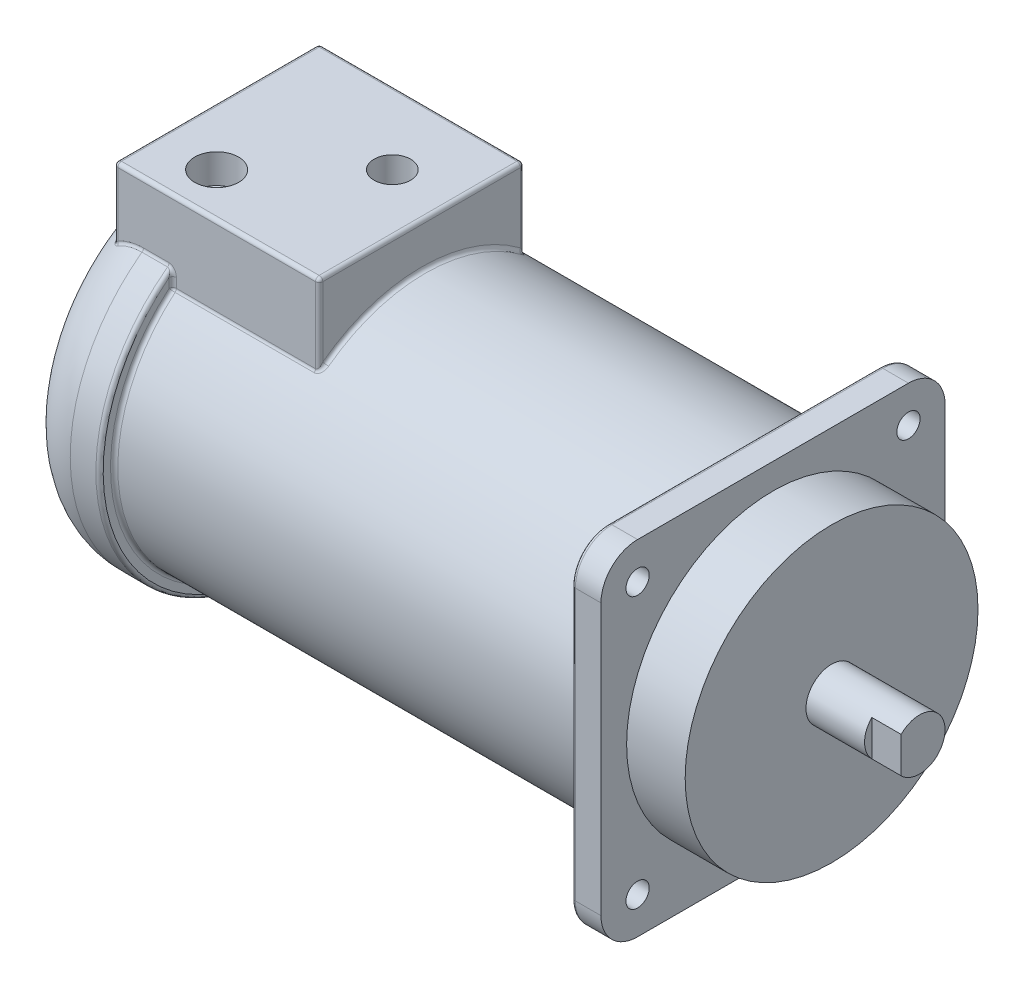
SolidWorks part; units mm, degrees
ref_plane "front" through (0, 0, 0) normal (0, 0, 1) x (1, 0, 0)
ref_plane "top" through (0, 0, 0) normal (0, 1, 0) x (1, 0, 0)
ref_plane "side" through (0, 0, 0) normal (1, 0, 0) x (0, 0, -1)
sketch "Sketch1" plane through (0, 0, 0) normal (0, 0, 1) x (1, 0, 0)
  line L0 (0, 0) -> (63.4876, 0) construction
  line L1 (0, 0) -> (0, 11.1125)
  line L2 (0, 11.1125) -> (-63.5, 11.1125)
  line L3 (-63.5, 11.1125) -> (-63.5, 69.85)
  line L6 (-63.5, 69.85) -> (-279.4, 69.85)
  line L7 (-279.4, 69.85) -> (-279.4, 76.2)
  line L8 (-279.4, 76.2) -> (-292.1, 76.2)
  line L9 (-317.5, 50.8) -> (-317.5, 0)
  line L10 (-317.5, 0) -> (0, 0)
  arc A0 (-292.1, 76.2) -> (-317.5, 50.8) centre (-292.1, 50.8) ccw
  dimension "D3" = 25.4
  dimension "D1" = 69.85
  dimension "D2" = 76.2
  dimension "D4" = 38.1
  dimension "D5" = 254
  dimension "D6" = 63.5
  dimension "D7" = 22.225
revolve "Base-Revolve" add sketch "Sketch1" angle 360 about L0
sketch "Sketch2" plane through (-63.5, 0, 0) normal (1, 0, 0) x (0, 0, -1)
  line L0 (0, 0) -> (0, 105.8986) construction
  line L1 (0, 0) -> (105.8986, 0) construction
  line L2 (74.6125, -58.7375) -> (74.6125, 58.7375)
  line L3 (58.7375, 74.6125) -> (-58.7375, 74.6125)
  line L4 (-74.6125, -58.7375) -> (-74.6125, 58.7375)
  line L5 (58.7375, -74.6125) -> (-58.7375, -74.6125)
  arc A0 (74.6125, 58.7375) -> (58.7375, 74.6125) centre (58.7375, 58.7375) ccw
  arc A1 (-74.6125, 58.7375) -> (-58.7375, 74.6125) centre (-58.7375, 58.7375) cw
  arc A2 (-74.6125, -58.7375) -> (-58.7375, -74.6125) centre (-58.7375, -58.7375) ccw
  arc A3 (74.6125, -58.7375) -> (58.7375, -74.6125) centre (58.7375, -58.7375) cw
  point P10 (0, 74.6125)
  point P11 (74.6125, 0)
  point P18 (-74.6125, 0)
  point P19 (0, -74.6125)
  dimension "D1" = 15.875
  dimension "D2" = 149.225
extrude "Boss-Extrude1" add sketch "Sketch2" against normal blind 12.7
ref_plane "Plane4" through (-215.9, 0, 0) normal (1, 0, 0) x (0, 0, -1)
sketch "Sketch3" plane through (-215.9, 0, 0) normal (1, 0, 0) x (0, 0, -1)
  line L0 (0, 0) -> (0, 88.9) construction
  line L1 (-44.45, 88.9) -> (44.45, 88.9)
  line L2 (-44.45, 88.9) -> (-44.45, 24.5934)
  line L3 (44.45, 24.5934) -> (-44.45, 24.5934)
  line L4 (44.45, 24.5934) -> (44.45, 88.9)
  circle A3 centre (0, 0) radius 50.8 construction
  circle A4 centre (0, 0) radius 11.1125 construction
  dimension "D2" = 88.9
  dimension "D1" = 88.9
extrude "Boss-Extrude2" add sketch "Sketch3" against normal blind 88.9
sketch "Sketch4" plane through (-63.5, 0, 0) normal (1, 0, 0) x (0, 0, -1)
  circle A0 centre (0, 0) radius 63.5
  dimension "D1" = 127
extrude "pilot dia" add sketch "Sketch4" along normal blind 25.4
sketch "Sketch6" plane through (0, 88.9, 0) normal (0, 1, 0) x (-1, 0, 0)
  line L0 (304.8, 44.45) -> (304.8, -44.45) construction
  line L1 (304.8, -44.45) -> (215.9, -44.45) construction
  circle A0 centre (279.4, 25.4) radius 9.525
  circle A1 centre (241.3, -12.7) radius 7.9375
  dimension "D1" = 25.4
  dimension "D2" = 38.1
  dimension "D3" = 31.75
  dimension "D4" = 38.1
  dimension "D5" = 19.05
  dimension "D6" = 15.875
extrude "Cut-Extrude2" cut sketch "Sketch6" against normal blind 12.7
fillet "Fillet1" radius 1.5875 7 edges at (-282.5238, -59.5693, -44.45) (-279.4, -76.2, 0) (-279.4, -69.85, 0) (-215.9, 71.3908, 44.45) (-215.9, 71.3908, -44.45) (-304.8, 73.2754, 44.45) (-304.8, 73.2754, -44.45)
fillet "Fillet2" radius 1.5875 18 edges at (-300.1465, 60.2742, 44.45) (-286.5437, 61.8921, -44.45) (-215.9, 69.85, 0) (-247.65, 53.8815, 44.45) (-286.5437, 61.8921, 44.45) (-279.4, 57.9255, 44.45) (-278.9494, 54.5017, 44.45) (-247.65, 53.8815, -44.45) (-279.4, 57.9255, -44.45) (-282.5238, -59.5693, -44.45) (-278.6382, 54.1815, -44.45) (-304.8, 72.797, 0) (-216.3546, 54.2703, 43.9745) (-216.6612, 54.0721, -44.218) (-304.2521, 58.3333, -44.0623) (-304.3887, 58.3401, 43.9287) (-279.7974, 61.23, 44.45) (-279.8536, 61.3046, -44.45)
fillet "Fillet3" radius 1.5875 17 edges at (-76.2, 0, -69.85) (-76.2, -69.9628, -69.9628) (-76.2, -74.6125, 0) (-76.2, 0, 74.6125) (-76.2, 69.9628, 69.9628) (-76.2, 69.9628, -69.9628) (-76.2, 0, -74.6125) (-76.2, -69.9628, 69.9628) (-76.2, 74.6125, 0) (-215.9, 88.9, 0) (-260.35, 88.9, 44.45) (-260.35, 88.9, -44.45) (-304.8, 88.9, 0) (-304.335, 88.9, 43.985) (-304.335, 88.9, -43.985) (-216.365, 88.9, -43.985) (-216.365, 88.9, 43.985)
sketch "Sketch7" plane through (0, 0, 0) normal (1, 0, 0) x (0, 0, -1)
  line L0 (-7.9375, -7.7771) -> (-7.9375, 7.7771)
  circle A0 centre (0, 0) radius 11.1125 construction
  arc A1 (-7.9375, 7.7771) -> (-7.9375, -7.7771) centre (0, 0) ccw
  dimension "D1" = 3.175
extrude "Cut-Extrude3" cut sketch "Sketch7" against normal blind 12.7
hole_wizard "3/8 Clearance Hole1" positions "3DSketch1" profile "Sketch8" hole size "3/8" standard "Ansi Inch"
sketch3d "3DSketch1"
  line L0 (-74.6125, 58.7375, 58.7375) -> (-63.5, 58.7375, 58.7375) construction
  line L1 (-74.6125, 58.7375, -58.7375) -> (-63.5, 58.7375, -58.7375) construction
  line L2 (-74.6125, -58.7375, -58.7375) -> (-63.5, -58.7375, -58.7375) construction
  line L3 (-74.6125, -58.7375, 58.7375) -> (-63.5, -58.7375, 58.7375) construction
  point P0 (-63.5, 58.7375, 58.7375)
  point P4 (-63.5, 58.7375, -58.7375)
  point P8 (-63.5, -58.7375, -58.7375)
  point P12 (-63.5, -58.7375, 58.7375)
sketch "Sketch8" plane through (-63.5, 58.7375, 58.7375) normal (0, 1, 0) x (0, 0, -1)
  line L0 (0, 0) -> (0, 254)
  line L1 (0, 254) -> (5.0419, 254)
  line L2 (5.0419, 254) -> (5.0419, 0)
  line L5 (5.0419, 0) -> (0, 0)
  line L11 (0, -6.35) -> (0, 107.95) construction
  dimension "Thru Hole Dia." = 10.0838
  dimension "Thru Hole Depth" = 254
